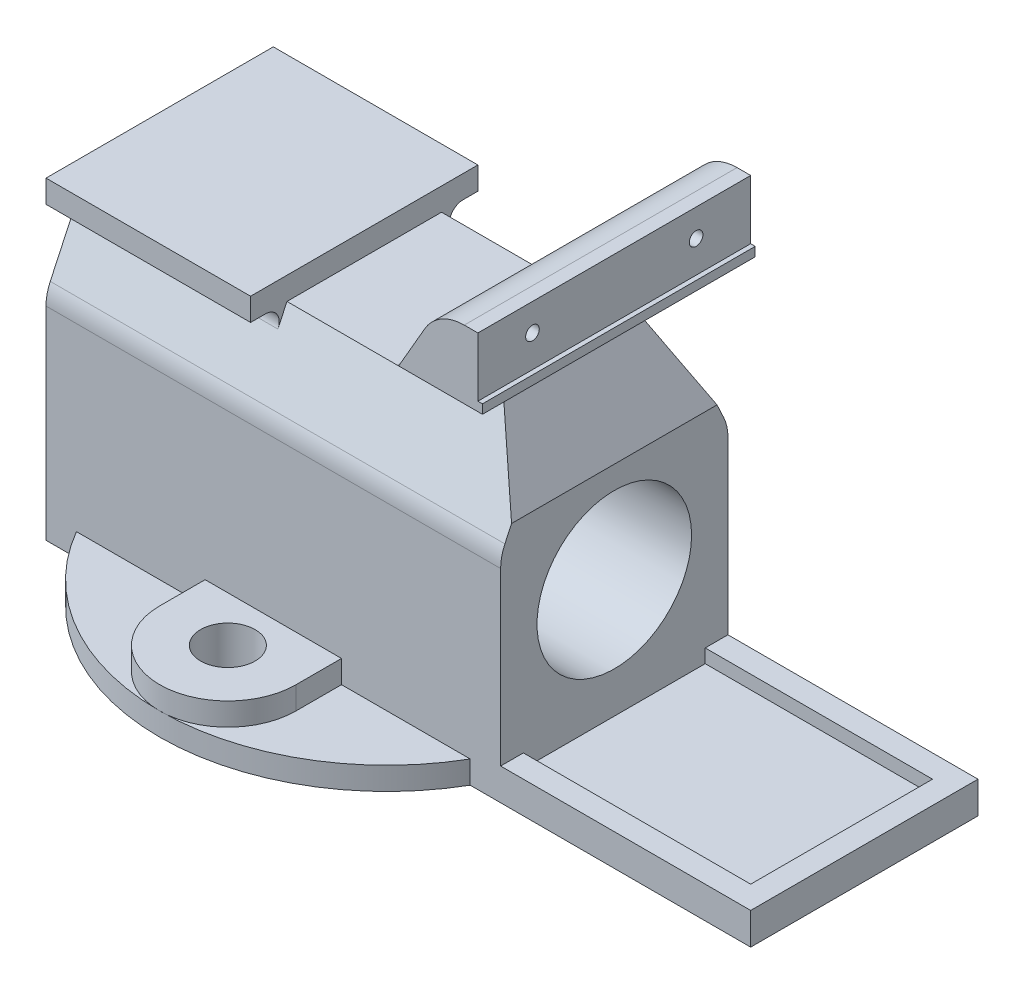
SolidWorks part; units mm, degrees
ref_plane "Front Plane" through (0, 0, 0) normal (0, 0, 1) x (1, 0, 0)
ref_plane "Top Plane" through (0, 0, 0) normal (0, 1, 0) x (1, 0, 0)
ref_plane "Right Plane" through (0, 0, 0) normal (1, 0, 0) x (0, 0, -1)
sketch "Sketch17" plane through (0, 0, 0) normal (0, 1, 0) x (1, 0, 0)
  circle A0 centre (0, 0) radius 50
  dimension "D1" = 100
extrude "Boss-Extrude9" add sketch "Sketch17" along normal blind 5 contours A0
sketch "Sketch2" plane through (0, 5, 0) normal (0, -1, 0) x (1, 0, 0)
  line L0 (0, -35) -> (0, 35) construction
  line L1 (-15, -35) -> (-15, 35)
  line L2 (15, -35) -> (15, 35)
  arc A0 (-15, -35) -> (15, -35) centre (0, -35) ccw
  arc A1 (15, 35) -> (-15, 35) centre (0, 35) ccw
  point P3 (0, 0)
  dimension "D2" = 15
  dimension "D1" = 70
extrude "Boss-Extrude1" add sketch "Sketch2" against normal blind 5
sketch "Sketch3" plane through (0, 10, 0) normal (0, 1, 0) x (1, 0, 0)
  circle A0 centre (0, 35) radius 6
  circle A1 centre (0, -35) radius 6
  dimension "D1" = 12
extrude "Cut-Extrude1" cut sketch "Sketch3" against normal through all
sketch "Sketch5" plane through (0, 0, 0) normal (1, 0, 0) x (0, 0, -1)
  line L0 (0, 0) -> (0, 70.9957) construction
  line L1 (17, 64) -> (-17, 64)
  line L2 (25, 44.627) -> (25, 0)
  line L3 (-24.0631, 48.8532) -> (-17, 64)
  line L4 (24.0631, 48.8532) -> (17, 64)
  line L20 (-25, 44.627) -> (-25, 0)
  line L21 (-25, 0) -> (25, 0)
  arc A0 (24.0631, 48.8532) -> (25, 44.627) centre (15, 44.627) cw
  arc A11 (-24.0631, 48.8532) -> (-25, 44.627) centre (-15, 44.627) ccw
  point P12 (0, 64)
  dimension "D3" = 10
  dimension "D2" = 34
  dimension "D1" = 64
  dimension "D4" = 25
  dimension "D5" = 50
extrude "Boss-Extrude3" add sketch "Sketch5" along normal mid plane 100
sketch "Sketch4" plane through (-50, 0, 0) normal (1, 0, 0) x (0, 0, -1)
  line L0 (-17, 64) -> (-18.9901, 59.7321)
  line L1 (25, 69) -> (-25, 69)
  line L2 (-25, 69) -> (-25, 64)
  line L6 (-25, 64) -> (-21.7091, 64)
  line L8 (0, 0) -> (0, 88.6242) construction
  line L9 (24.0631, 48.8532) -> (17, 64) construction
  line L12 (25, 64) -> (21.7091, 64)
  line L14 (25, 69) -> (25, 64)
  line L15 (24.0631, 48.8532) -> (17, 64) construction
  line L17 (17, 64) -> (-17, 64) construction
  line L19 (17, 64) -> (-17, 64)
  line L20 (18.9901, 59.7321) -> (17, 64)
  arc A0 (-21.7091, 64) -> (-18.9901, 59.7321) centre (-21.7091, 61) cw
  arc A4 (21.7091, 64) -> (18.9901, 59.7321) centre (21.7091, 61) ccw
  point P28 (0, 69)
  dimension "D9" = 3
  dimension "D1" = 50
  dimension "D7" = 5
sketch "Sketch6" plane through (0, 0, 25) normal (0, 0, 1) x (1, 0, 0)
  line L0 (50, 7) -> (50, 0)
  line L4 (105, 0) -> (105, 7)
  line L5 (105, 7) -> (50, 7)
  line L7 (0, 0) -> (138.7494, 0) construction
  line L8 (50, 44.627) -> (50, 0) construction
  line L9 (50, 0) -> (105, 0)
  dimension "D1" = 55
  dimension "D3" = 7
extrude "Boss-Extrude7" add sketch "Sketch4" along normal blind 45
extrude "Boss-Extrude4" add sketch "Sketch6" against normal up to surface (50 mm away)
sketch "Sketch7" plane through (0, 0, 0) normal (0, 0, 1) x (1, 0, 0)
  line L0 (50, 64) -> (50, 92)
  line L4 (25.0607, 64) -> (50, 64)
  line L5 (25.0607, 64) -> (38.3397, 87)
  line L6 (50, 64) -> (-5, 64) construction
  line L7 (50, 92) -> (47, 92)
  arc A2 (38.3397, 87) -> (47, 92) centre (47, 82) cw
  point P5 (41.2265, 92)
  dimension "D1" = 3
  dimension "D2" = 28
  dimension "D6" = 10
  dimension "D4" = 120
extrude "Boss-Extrude5" add sketch "Sketch7" along normal mid plane 60 contours L0 L7 A2 L5 L4
sketch "Sketch8" plane through (0, 0, 30) normal (0, 0, 1) x (1, 0, 0)
  line L0 (50, 52) -> (50, 77)
  line L1 (50, 64) -> (50, 92) construction
  line L2 (50, 92) -> (47, 92) construction
  line L3 (50, 77) -> (44.2265, 77)
  line L4 (39.8964, 69.5) -> (50, 52)
  arc A0 (44.2265, 77) -> (39.8964, 69.5) centre (44.2265, 72) ccw
  dimension "D1" = 40
  dimension "D3" = 5
  dimension "D2" = 15
  dimension "D4" = 30
extrude "Cut-Extrude2" cut sketch "Sketch8" against normal through all
sketch "Sketch10" plane through (50, 0, 0) normal (1, 0, 0) x (0, 0, -1)
  line L0 (0, 0) -> (0, 100.0467) construction
  line L1 (30, 77) -> (30, 36.1214)
  line L2 (30, 36.1214) -> (15.5816, 67.0417)
  line L4 (30, 77) -> (21.9258, 77)
  line L5 (-30, 77) -> (-21.9258, 77)
  line L6 (-30, 36.1214) -> (-15.5816, 67.0417)
  line L7 (-30, 77) -> (-30, 36.1214)
  line L8 (24.0631, 48.8532) -> (22.5957, 52) construction
  line L9 (30, 77) -> (-30, 77) construction
  arc A0 (21.9258, 77) -> (15.5816, 67.0417) centre (21.9258, 70) ccw
  arc A1 (-21.9258, 77) -> (-15.5816, 67.0417) centre (-21.9258, 70) cw
  dimension "D1" = 7
extrude "Cut-Extrude4" cut sketch "Sketch10" against normal up to next
sketch "Sketch12" plane through (50, 0, 0) normal (1, 0, 0) x (0, 0, -1)
  line L0 (30, 77) -> (30, 92) construction
  line L1 (-30, 77) -> (30, 77)
  line L2 (-30, 77) -> (-30, 79)
  line L3 (-30, 79) -> (30, 79)
  line L4 (30, 77) -> (30, 79)
  point P5 (30, 78)
  dimension "D1" = 2
extrude "Boss-Extrude6" add sketch "Sketch12" along normal blind 1
sketch "Sketch14" plane through (50, 0, 0) normal (1, 0, 0) x (0, 0, -1)
  circle A0 centre (0, 30) radius 17
  dimension "D2" = 34
  dimension "D1" = 30
extrude "Cut-Extrude7" cut sketch "Sketch14" against normal through all
sketch "Sketch15" plane through (50, 0, 0) normal (1, 0, 0) x (0, 0, -1)
  line L0 (0, 0) -> (0, 104.8859) construction
  line L1 (-30, 92) -> (30, 92) construction
  circle A0 centre (-18, 86) radius 1.5
  circle A1 centre (18, 86) radius 1.5
  dimension "D2" = 3
  dimension "D1" = 36
  dimension "D3" = 6
extrude "Cut-Extrude8" cut sketch "Sketch15" against normal blind 5
sketch "Sketch18" plane through (0, 7, 0) normal (0, 1, 0) x (1, 0, 0)
  line L6 (50, 20) -> (50, -20)
  line L9 (100, 20) -> (100, -20)
  line L10 (100, -20) -> (50, -20)
  line L11 (50, 20) -> (100, 20)
  line L12 (100, 20) -> (100, -20)
  line L13 (100, -20) -> (50, -20)
  line L14 (50, 20) -> (100, 20)
  dimension "D1" = 5
extrude "Cut-Extrude9" cut sketch "Sketch18" against normal blind 3
fillet "Fillet1" radius 10 1 edges at (25.0607, 64, 0)
sketch "Sketch19" plane through (-50, 0, 0) normal (-1, 0, 0) x (0, 0, 1)
  line L0 (0, 30) -> (38.209, 30) construction
  circle A0 centre (0, 52.5) radius 2.5
  circle A1 centre (0, 7.5) radius 2.5
  dimension "D2" = 5
  dimension "D1" = 45
extrude "Cut-Extrude10" cut sketch "Sketch19" against normal blind 10
